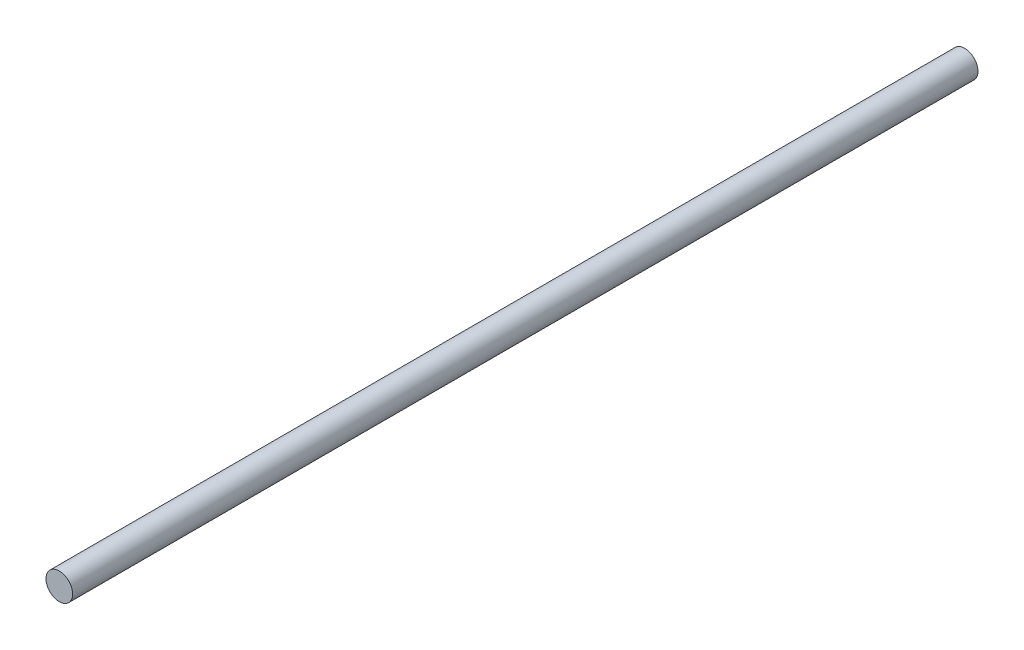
SolidWorks part; units mm, degrees
ref_plane "Front Plane" through (0, 0, 0) normal (0, 0, 1) x (1, 0, 0)
ref_plane "Top Plane" through (0, 0, 0) normal (0, 1, 0) x (1, 0, 0)
ref_plane "Right Plane" through (0, 0, 0) normal (1, 0, 0) x (0, 0, -1)
sketch "Sketch2" plane through (0, 0, 0) normal (0, 0, 1) x (1, 0, 0)
  circle A0 centre (0, 0) radius 2.5
  dimension "D1" = 5
extrude "Boss-Extrude1" add sketch "Sketch2" along normal blind 170
